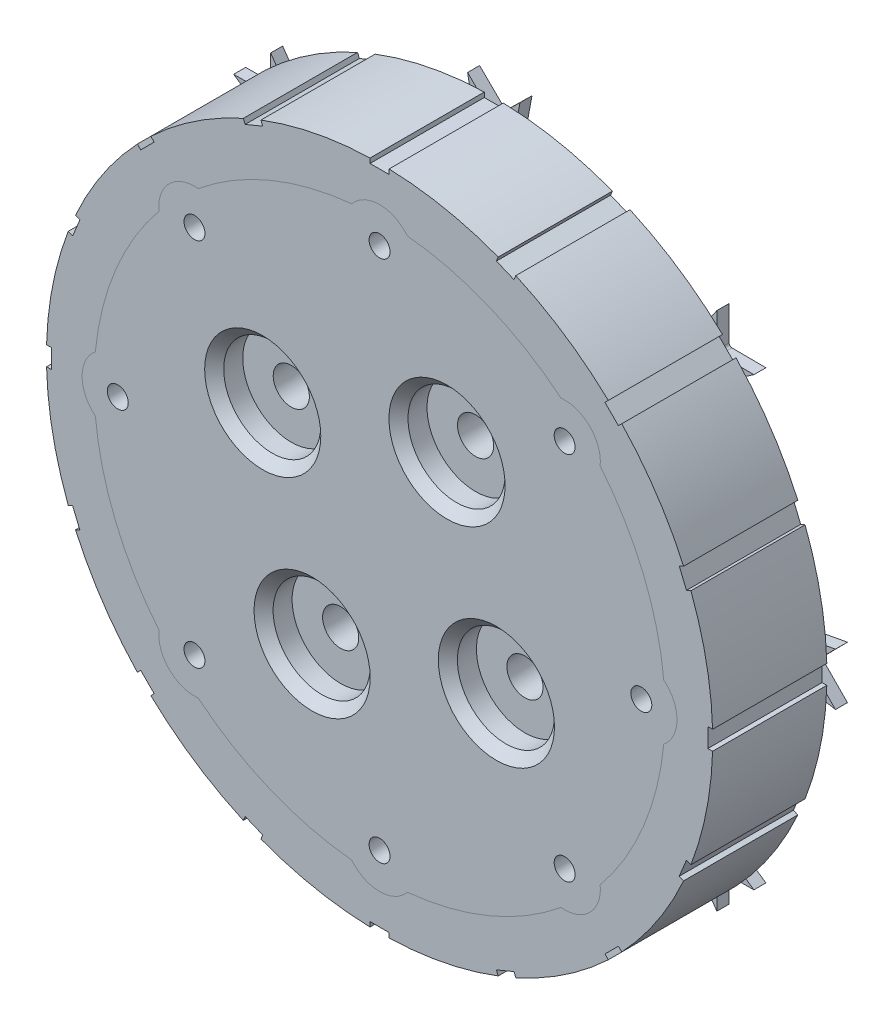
SolidWorks part; units mm, degrees
other "Hub"
other "Cleat"
other "Tire"
other "Mold Wall" parameters "D1"=32.9217, "D2"=23.0682, "D3"=8.255, "D4"=3.6898, "D5"=6.9844, "D6"=4.4103, "D7"=8.255
ref_plane "Front Plane" through (0, 0, 0) normal (0, 0, 1) x (1, 0, 0)
ref_plane "Top Plane" through (0, 0, 0) normal (0, 1, 0) x (1, 0, 0)
ref_plane "Right Plane" through (0, 0, 0) normal (1, 0, 0) x (0, 0, -1)
other "Bounding Box"
ref_plane "Default Plane" through (-8.9266, -12.7485, 0) normal (-0.1736, 0.9848, 0) x (0.9848, 0.1736, 0)
sketch "Sketch4" plane through (0, 0, 0) normal (1, 0, 0) x (0, 0, -1)
  line L0 (0, 0) -> (7.62, 0)
  line L1 (7.62, 0) -> (7.62, 38.1)
  line L2 (7.62, 38.1) -> (5.08, 38.1)
  line L3 (5.08, 38.1) -> (2.54, 25.4)
  line L4 (2.54, 25.4) -> (-2.54, 25.4)
  line L5 (-2.54, 25.4) -> (-5.08, 38.1)
  line L6 (-5.08, 38.1) -> (-7.62, 38.1)
  line L7 (-7.62, 38.1) -> (-7.62, 0)
  line L8 (-7.62, 0) -> (0, 0)
  line L9 (-26.5273, 44.45) -> (23587.5035, 44.45) construction
  line L10 (-36.4166, -44.45) -> (23577.6141, -44.45) construction
  line L11 (-7.4542, 0) -> (49992.5458, 0) construction
revolve "Revolve1" add sketch "Sketch4" angle 360 about L11
sketch "Sketch6" plane through (0, 0, 7.62) normal (0, 0, 1) x (1, 0, 0)
  line L0 (-4.7625, 34.925) -> (-4.7625, 0)
  line L1 (-4.7625, 0) -> (4.7625, 0)
  line L2 (4.7625, 0) -> (4.7625, 34.925)
  line L3 (0, 39.6875) -> (0, 44.45) construction
  arc A0 (4.7625, 34.925) -> (-4.7625, 34.925) centre (0, 34.925) ccw
  circle A1 centre (0, 0) radius 44.45 construction
extrude "Boss-Extrude2" add sketch "Sketch6" against normal up to vertex (16.51 mm away)
mirror "Mirror1" about plane through (0, 0, 0) normal (0, 0, 1) of "Boss-Extrude2"
sketch "Sketch7" plane through (0, 0, 5.08) normal (0, 0, -1) x (-1, 0, 0)
  circle A0 centre (0, 34.925) radius 4.7625
  arc A2 (3.7032, 37.9196) -> (-3.7032, 37.9196) centre (0, 34.925) ccw construction
extrude "Boss-Extrude3" add sketch "Sketch7" along normal up to surface (12.7 mm away)
sketch "Sketch8" plane through (0, 0, -7.62) normal (0, 0, -1) x (-1, 0, 0)
  circle A0 centre (0, 34.925) radius 1.397
extrude "Cut-Extrude2" cut sketch "Sketch8" against normal through all
fillet "Fillet2" radius 1.27 2 edges at (0.6334, 30.2048, -3.5023) (-0.6334, 30.2048, 3.5023)
pattern_circular "CirPattern2" count 8 over 360 of "Cut-Extrude2", "Boss-Extrude3", "Mirror1", "Boss-Extrude2", "Fillet2"
fillet "Fillet1" radius 1.27 2 edges at (25.4, 0, -2.54) (25.4, 0, 2.54)
sketch "Sketch2" plane through (0, 0, 0) normal (0, 0, 1) x (1, 0, 0)
  circle A0 centre (0, 0) radius 44.45
extrude "Boss-Extrude1" add sketch "Sketch2" along normal mid plane 15.24 separate body
sketch "Sketch3" plane through (0, 0, 7.62) normal (0, 0, 1) x (1, 0, 0)
  line L0 (-1.27, 44.4319) -> (-1.27, 43.7969)
  line L1 (-1.27, 43.7969) -> (1.27, 43.7969)
  line L2 (1.27, 43.7969) -> (1.27, 44.4319)
  line L3 (0, 43.7969) -> (0, 0) construction
  circle A0 centre (0, 0) radius 44.45 construction
  arc A1 (-1.27, 44.4319) -> (1.27, 44.4319) centre (0, 0) cw
  dimension "D1" = 0.635
  dimension "D2" = 2.54
extrude "Cut-Extrude1" cut sketch "Sketch3" against normal through all
pattern_circular "CirPattern1" count 16 over 360 about axis through (0, 0, 0) along (0, 0, 1) of "Cut-Extrude1"
move or copy body "Body-Move/Copy1" parameters "D1"=0, "D2"=0, "D3"=0
combine bodies "Combine1" bodies to combine 106 113
sketch "Sketch9" plane through (0, 0, -7.62) normal (0, 0, -1) x (-1, 0, 0)
  line L0 (0, 32.0675) -> (0, 35.8775) construction
  line L1 (0, 35.8775) -> (0, 39.6875) construction
  circle A0 centre (0, 0) radius 9.525 construction
  circle A1 centre (0, 0) radius 32.0675
  circle A2 centre (0, 0) radius 39.6875
  arc A4 (3.7032, 37.9196) -> (-3.7032, 37.9196) centre (0, 34.925) ccw construction
  dimension "D2" = 19.05
  dimension "D1" = 7.62
extrude "Boss-Extrude4" add sketch "Sketch9" along normal blind 1.6002 separate body
sketch "Sketch11" plane through (0, 0, -9.2202) normal (0, 0, -1) x (-1, 0, 0)
  circle A0 centre (0, 34.925) radius 4.445
  point P3 (0, 15.3326)
  dimension "D1" = 4.445
extrude "Boss-Extrude6" add sketch "Sketch11" against normal up to surface (1.6002 mm away)
sketch "Sketch12" plane through (0, 0, -9.2202) normal (0, 0, -1) x (-1, 0, 0)
  circle A0 centre (0, 34.925) radius 1.905
extrude "Cut-Extrude3" cut sketch "Sketch12" against normal through all
fillet "Fillet4" radius 3.81 2 edges at (-3.2583, 31.9015, -8.4201) (3.2583, 31.9015, -8.4201)
pattern_circular "CirPattern19" count 8 over 360 about axis through (0, 0, 0) along (0, 0, 1) of "Cut-Extrude3", "Fillet4", "Boss-Extrude6"
sketch "Sketch13" plane through (0, 0, -9.2202) normal (0, 0, -1) x (-1, 0, 0)
  line L1 (0, -7.479) -> (6.477, -3.7395)
  line L2 (6.477, -3.7395) -> (6.477, 3.7395)
  line L3 (6.477, 3.7395) -> (0, 7.479)
  line L4 (0, 7.479) -> (-6.477, 3.7395)
  line L5 (-6.477, 3.7395) -> (-6.477, -3.7395)
  line L6 (-6.477, -3.7395) -> (0, -7.479)
  circle A0 centre (0, 0) radius 6.477 construction
extrude "Cut-Extrude4" cut sketch "Sketch13" against normal through all
sketch "Sketch14" plane through (0, 0, -9.2202) normal (0, 0, -1) x (-1, 0, 0)
  line L3 (-2.3986, 39.615) -> (-3.4925, 45.5864)
  line L4 (-3.4925, 45.5864) -> (0, 42.1401)
  line L8 (-3.4925, 45.5864) -> (0, 0) construction
  line L10 (0, 0) -> (0, 50000) construction
  line L11 (-3.4925, 45.5864) -> (0, 45.5864) construction
  line L12 (0, 42.1401) -> (3.4925, 45.5864)
  line L13 (3.4925, 45.5864) -> (2.3986, 39.615)
  line L14 (2.3986, 39.615) -> (-2.3986, 39.615)
  circle A2 centre (0, 0) radius 44.45 construction
  arc A3 (-32.3161, 30.52) -> (-40.5637, 18.1767) centre (0, 0) ccw construction
  circle A4 centre (0, 0) radius 45.72 construction
  circle A5 centre (0, 0) radius 39.6875 construction
  dimension "D1" = 1.27
  dimension "D2" = 6
  dimension "D3" = 6.985
  dimension "D4" = 35
extrude "Boss-Extrude8" add sketch "Sketch14" against normal up to surface (1.6002 mm away)
fillet "Fillet6" radius 0.381 1 edges at (0, 42.1401, -8.4201)
fillet "Fillet7" radius 2.286 2 edges at (2.3986, 39.615, -8.4201) (-2.3986, 39.615, -8.4201)
pattern_circular "CirPattern27" count 8 over 360 about axis through (0, 0, 0) along (0, 0, 1) of "Boss-Extrude8", "Fillet7", "Fillet6"
sketch "Sketch15" plane through (0, 0, 7.62) normal (0, 0, 1) x (1, 0, 0)
  circle A0 centre (0, 0) radius 47.625
  arc A1 (-41.5357, 15.83) -> (-44.4319, 1.27) centre (0, 0) ccw construction
  dimension "D1" = 3.175
extrude "Boss-Extrude9" add sketch "Sketch15" against normal up to surface (15.24 mm away) separate body
move or copy body "Body-Move/Copy2" parameters "D1"=0, "D2"=0, "D3"=0
combine bodies "Combine2" bodies to combine 126 127 128
sketch "Sketch17" plane through (0, 0, 0) normal (0, 1, 0) x (1, 0, 0)
  line L0 (0, -10.16) -> (0, -7.62)
  line L1 (0, -7.62) -> (-47.7012, -7.62)
  line L2 (-47.7012, -7.62) -> (-47.7012, -1.27)
  line L3 (-47.7012, -1.27) -> (-50.2412, -1.27)
  line L4 (-50.2412, -1.27) -> (-50.2412, -10.16)
  line L5 (-50.2412, -10.16) -> (0, -10.16)
  line L6 (-47.625, -7.62) -> (47.625, -7.62) construction
  line L7 (-47.625, 7.62) -> (-47.625, -7.62) construction
  dimension "D1" = 2.54
  dimension "D2" = 0.0762
  dimension "D3" = 6.35
  dimension "D4" = 2.54
revolve "Revolve2" add sketch "Sketch17" angle 360 about L0
sketch "Sketch18" plane through (0, 0, 0) normal (0, 1, 0) x (1, 0, 0)
  line L0 (-47.625, 7.62) -> (-53.975, 13.97)
  line L1 (-53.975, 13.97) -> (-50.8, 13.97)
  line L2 (-50.8, 13.97) -> (-44.45, 7.62)
  line L3 (47.625, 7.62) -> (-47.625, 7.62) construction
  line L4 (-44.45, 7.62) -> (-47.625, 7.62)
  line L5 (0, 0) -> (0, 50000) construction
  dimension "D1" = 45
  dimension "D2" = 6.35
  dimension "D3" = 3.175
revolve "Revolve3" add sketch "Sketch18" angle 360 about L5
fillet "Fillet9" radius 5.08 1 edges at (47.625, 0, -7.62)
sketch "Sketch22" plane through (0, 0, -9.2202) normal (0, 0, -1) x (-1, 0, 0)
  circle A0 centre (0, 0) radius 30.734
  dimension "D1" = 61.468
extrude "Cut-Extrude6" cut sketch "Sketch22" against normal through all
sketch "Sketch56" plane through (0, 0, 7.62) normal (0, 0, 1) x (1, 0, 0)
  line L0 (6.477, -3.7395) -> (0, -7.479) construction
  line B0 (-12.0316, -4.2591) -> (-13.9201, -14.6984)
  line B1 (19.4044, -5.7691) -> (12.5493, 2.3273)
  line B2 (12.0316, 4.2591) -> (13.9201, 14.6984)
  line B3 (-19.4044, 5.7691) -> (-12.5493, -2.3273)
  line B4 (-6.35, 2.7695) -> (-6.35, -2.635)
  line B5 (-0.893, 6.8168) -> (-5.5735, 4.1145)
  line B6 (5.457, 4.1818) -> (0.893, 6.8168)
  line B7 (6.35, -2.7695) -> (6.35, 2.635)
  line B8 (0.893, -6.8168) -> (5.5735, -4.1145)
  line B9 (-5.457, -4.1818) -> (-0.893, -6.8168)
  circle B10 centre (-15.5885, 9) radius 2.0333
  circle B11 centre (9, 15.5885) radius 2.0333
  circle B12 centre (15.5885, -9) radius 2.0333
  arc B13 (-12.0316, -4.2591) -> (-12.5493, -2.3273) centre (-14.3381, -3.8419) ccw
  arc B14 (-13.9201, -14.6984) -> (-11.5, -19.9186) centre (-9, -15.5885) ccw
  arc B15 (-11.5, -19.9186) -> (19.9186, -11.5) centre (0, 0) ccw
  arc B16 (19.9186, -11.5) -> (19.4044, -5.7691) centre (15.5885, -9) ccw
  arc B17 (12.0316, 4.2591) -> (12.5493, 2.3273) centre (14.3381, 3.8419) ccw
  arc B18 (13.9201, 14.6984) -> (11.5, 19.9186) centre (9, 15.5885) ccw
  arc B19 (11.5, 19.9186) -> (-19.9186, 11.5) centre (0, 0) ccw
  arc B20 (-19.9186, 11.5) -> (-19.4044, 5.7691) centre (-15.5885, 9) ccw
  circle B21 centre (-9, -15.5885) radius 2.0333
  arc B22 (-10.7596, 10.2969) -> (-6.35, 2.7695) centre (5.1757, 14.5766) ccw
  arc B23 (-8.2319, 16.0074) -> (-10.7596, 10.2969) centre (-5.9583, 11.5863) ccw
  arc B24 (2.9523, 13.2062) -> (5.0877, 10.3977) centre (9, 15.5885) ccw
  arc B25 (-7.5459, 14.6734) -> (-9.3109, 10.6859) centre (-5.9583, 11.5863) ccw
  arc B26 (10.7596, -10.2969) -> (6.35, -2.7695) centre (-5.1757, -14.5766) ccw
  arc B27 (8.2319, -16.0074) -> (10.7596, -10.2969) centre (5.9583, -11.5863) ccw
  arc B28 (0.8747, -17.9787) -> (8.2319, -16.0074) centre (0, 0) ccw
  arc B29 (-4.1696, -14.2971) -> (0.8747, -17.9787) centre (0.6331, -13.0132) ccw
  arc B30 (-5.0877, -10.3977) -> (-5.9905, -11.5956) centre (-5.5391, -10.9966) ccw
  arc B31 (-2.9523, -13.2062) -> (-5.0877, -10.3977) centre (-9, -15.5885) ccw
  arc B32 (2.4388, -16.3188) -> (7.5459, -14.6734) centre (0, 0) ccw
  arc B33 (9.3109, -10.6859) -> (5.5735, -4.1145) centre (-5.1757, -14.5766) ccw
sketch_block_instance "Block-CoolS-2"
sketch_block "Block-CoolS"
sketch "Sketch36" plane through (0, 0, -7.62) normal (0, 0, -1) x (-1, 0, 0)
  line L0 (0, 0) -> (0, 13.5) construction
  line L9 (-19.4044, -5.7691) -> (-12.5493, 2.3273) construction
  line L10 (-12.0316, 4.2591) -> (-13.9201, 14.6984) construction
  line L11 (19.4044, 5.7691) -> (12.5493, -2.3273) construction
  line L12 (12.0316, -4.2591) -> (13.9201, -14.6984) construction
  line L13 (-19.4044, -5.7691) -> (-12.5493, 2.3273)
  line L14 (-12.0316, 4.2591) -> (-13.9201, 14.6984)
  line L15 (19.4044, 5.7691) -> (12.5493, -2.3273)
  line L16 (12.0316, -4.2591) -> (13.9201, -14.6984)
  arc A16 (-19.4044, -5.7691) -> (-19.9186, -11.5) centre (-15.5885, -9) ccw construction
  arc A17 (-12.5493, 2.3273) -> (-12.0316, 4.2591) centre (-14.3381, 3.8419) ccw construction
  arc A18 (-11.5, 19.9186) -> (-13.9201, 14.6984) centre (-9, 15.5885) ccw construction
  arc A19 (19.9186, 11.5) -> (-11.5, 19.9186) centre (0, 0) ccw construction
  arc A20 (19.4044, 5.7691) -> (19.9186, 11.5) centre (15.5885, 9) ccw construction
  arc A21 (12.5493, -2.3273) -> (12.0316, -4.2591) centre (14.3381, -3.8419) ccw construction
  arc A22 (11.5, -19.9186) -> (13.9201, -14.6984) centre (9, -15.5885) ccw construction
  arc A23 (-19.9186, -11.5) -> (11.5, -19.9186) centre (0, 0) ccw construction
  arc A24 (-19.4044, -5.7691) -> (-19.9186, -11.5) centre (-15.5885, -9) ccw
  arc A25 (-12.5493, 2.3273) -> (-12.0316, 4.2591) centre (-14.3381, 3.8419) ccw
  arc A26 (-11.5, 19.9186) -> (-13.9201, 14.6984) centre (-9, 15.5885) ccw
  arc A27 (19.9186, 11.5) -> (-11.5, 19.9186) centre (0, 0) ccw
  arc A28 (19.4044, 5.7691) -> (19.9186, 11.5) centre (15.5885, 9) ccw
  arc A29 (12.5493, -2.3273) -> (12.0316, -4.2591) centre (14.3381, -3.8419) ccw
  arc A30 (11.5, -19.9186) -> (13.9201, -14.6984) centre (9, -15.5885) ccw
  arc A31 (-19.9186, -11.5) -> (11.5, -19.9186) centre (0, 0) ccw
extrude "Cut-Extrude11" cut sketch "Sketch36" against normal blind 5.08
sketch "Sketch37" plane through (0, 0, -7.62) normal (0, 0, -1) x (-1, 0, 0)
  line L4 (-12.5493, 2.3273) -> (-19.4044, -5.7691)
  line L6 (-12.5493, 2.3273) -> (-19.4044, -5.7691)
  line L8 (13.9201, -14.6984) -> (12.0316, -4.2591)
  line L10 (13.9201, -14.6984) -> (12.0316, -4.2591)
  line L12 (-13.9201, 14.6984) -> (-12.0316, 4.2591)
  line L13 (-13.9201, 14.6984) -> (-12.0316, 4.2591)
  line L14 (12.5493, -2.3273) -> (19.4044, 5.7691)
  line L15 (12.5493, -2.3273) -> (19.4044, 5.7691)
  circle A1 centre (0, 0) radius 24.13
  arc A9 (-19.4044, -5.7691) -> (-19.9186, -11.5) centre (-15.5885, -9) ccw
  arc A11 (-19.9186, -11.5) -> (11.5, -19.9186) centre (0, 0) ccw
  arc A12 (-19.9186, -11.5) -> (11.5, -19.9186) centre (0, 0) ccw
  arc A13 (-19.4044, -5.7691) -> (-19.9186, -11.5) centre (-15.5885, -9) ccw
  arc A15 (12.5493, -2.3273) -> (12.0316, -4.2591) centre (14.3381, -3.8419) ccw
  arc A16 (12.5493, -2.3273) -> (12.0316, -4.2591) centre (14.3381, -3.8419) ccw
  arc A17 (11.5, -19.9186) -> (13.9201, -14.6984) centre (9, -15.5885) ccw
  arc A19 (11.5, -19.9186) -> (13.9201, -14.6984) centre (9, -15.5885) ccw
  arc A21 (19.4044, 5.7691) -> (19.9186, 11.5) centre (15.5885, 9) ccw
  arc A23 (-12.5493, 2.3273) -> (-12.0316, 4.2591) centre (-14.3381, 3.8419) ccw
  arc A24 (-12.5493, 2.3273) -> (-12.0316, 4.2591) centre (-14.3381, 3.8419) ccw
  arc A25 (19.4044, 5.7691) -> (19.9186, 11.5) centre (15.5885, 9) ccw
  arc A26 (-11.5, 19.9186) -> (-13.9201, 14.6984) centre (-9, 15.5885) ccw
  arc A27 (-11.5, 19.9186) -> (-13.9201, 14.6984) centre (-9, 15.5885) ccw
  arc A28 (19.9186, 11.5) -> (-11.5, 19.9186) centre (0, 0) ccw
  arc A29 (19.9186, 11.5) -> (-11.5, 19.9186) centre (0, 0) ccw
  dimension "D2" = 48.26
  dimension "D1" = 0
extrude "Boss-Extrude12" add sketch "Sketch37" along normal offset from surface (4.445 mm away) 9.525
chamfer "Chamfer3" distance 5.715 angle 45 2 edges at (24.13, 0, -7.62) (-24.13, 0, -12.065)
sketch "Sketch39" plane through (0, 0, -2.54) normal (0, 0, -1) x (-1, 0, 0)
  circle A0 centre (-9, 15.5885) radius 2.413
  circle A1 centre (15.5885, 9) radius 2.413
  circle A2 centre (9, -15.5885) radius 2.413
  circle A3 centre (-15.5885, -9) radius 2.413
  dimension "D1" = 4.826
extrude "Cut-Extrude12" cut sketch "Sketch39" against normal through all
sketch "Sketch50" plane through (0, 0, 7.62) normal (0, 0, 1) x (1, 0, 0)
  circle A0 centre (-15.5885, 9) radius 6.477
  circle A1 centre (9, 15.5885) radius 6.477
  circle A2 centre (15.5885, -9) radius 6.477
  circle A3 centre (-9, -15.5885) radius 6.477
  dimension "D1" = 12.954
extrude "Cut-Extrude13" cut sketch "Sketch50" against normal blind 3.81
sketch "Sketch54" plane through (0, 0, -12.065) normal (0, 0, -1) x (-1, 0, 0)
  line L0 (19.4044, 5.7691) -> (12.5493, -2.3273) construction
  line L1 (-19.4044, -5.7691) -> (-12.5493, 2.3273) construction
  circle A0 centre (-15.9768, -1.7209) radius 5.08
  circle A1 centre (15.9768, 1.7209) radius 5.08
  dimension "D1" = 10.16
extrude "Cut-Extrude14" cut sketch "Sketch54" against normal up to surface (9.525 mm away)
fillet "Fillet10" radius 3.81 4 edges at (-12.6942, -2.1561, -7.3025) (-19.2594, 5.5979, -7.3025) (12.6942, 2.1561, -7.3025) (19.2594, -5.5979, -7.3025)
sketch "Sketch57" plane through (0, 0, 7.62) normal (0, 0, 1) x (1, 0, 0)
  line L0 (6.477, 3.7395) -> (6.477, -3.7395) construction
  line L1 (0, 7.479) -> (6.477, 3.7395) construction
  line L2 (-6.477, 3.7395) -> (0, 7.479) construction
  line L3 (-6.477, -3.7395) -> (-6.477, 3.7395) construction
  line L4 (0, -7.479) -> (-6.477, -3.7395) construction
  line L5 (6.477, -3.7395) -> (0, -7.479) construction
  line L6 (6.477, 3.7395) -> (6.477, -3.7395)
  line L7 (0, 7.479) -> (6.477, 3.7395)
  line L8 (-6.477, 3.7395) -> (0, 7.479)
  line L9 (-6.477, -3.7395) -> (-6.477, 3.7395)
  line L10 (0, -7.479) -> (-6.477, -3.7395)
  line L11 (6.477, -3.7395) -> (0, -7.479)
extrude "Boss-Extrude13" add sketch "Sketch57" against normal blind 5.08
chamfer "Chamfer4" distance 1.27 angle 45 4 edges at (-2.523, -15.5885, 7.62) (22.0655, -9, 7.62) (15.477, 15.5885, 7.62) (-9.1115, 9, 7.62)
sketch "Sketch60" [suppressed] plane through (0, 0, 7.62) normal (0, 0, -1) x (-1, 0, 0)
  circle A0 centre (15.5885, 9) radius 2.413 construction
  circle A1 centre (9, -15.5885) radius 2.413 construction
  circle A2 centre (-15.5885, -9) radius 2.413 construction
  circle A3 centre (-9, 15.5885) radius 2.413 construction
  circle A4 centre (15.5885, 9) radius 2.413
  circle A5 centre (9, -15.5885) radius 2.413
  circle A6 centre (-15.5885, -9) radius 2.413
  circle A7 centre (-9, 15.5885) radius 2.413
extrude "Boss-Extrude14" [suppressed] add sketch "Sketch60" along normal blind 19.05
chamfer "Chamfer5" [suppressed] distance 4.318 angle 45
chamfer "Chamfer6" [suppressed] distance 0.762 angle 45
fillet "Fillet11" [suppressed] radius 2.54
delete or keep bodies "Body-Delete/Keep 2" bodies 131 132
delete or keep bodies "Body-Delete/Keep 3" [suppressed] bodies 135
delete or keep bodies "Body-Delete/Keep 4" [suppressed] type keep bodies bodies 132 156
sketch "Sketch61" [suppressed] plane through (0, 0, -9.2202) normal (0, 0, -1) x (-1, 0, 0)
  line L0 (-3.4925, 45.5864) -> (-2.776, 41.675) construction
  line L1 (-27.5058, 31.4316) -> (-29.7649, 34.704) construction
  line L2 (-3.1352, 43.636) -> (-2.776, 41.675)
  line L3 (-27.5058, 31.4316) -> (-28.6384, 33.0723)
  arc A0 (-4.2081, 33.4932) -> (-1.389, 30.7026) centre (0, 34.925) ccw construction
  arc A1 (-4.2081, 33.4932) -> (-7.1165, 35.1646) centre (-6.6127, 32.6751) ccw construction
  arc A2 (-7.1165, 35.1646) -> (-19.833, 29.8973) centre (0, 0) ccw construction
  arc A3 (-19.833, 29.8973) -> (-20.7077, 26.6589) centre (-18.4289, 27.7807) ccw construction
  arc A4 (-20.7278, 22.6922) -> (-20.7077, 26.6589) centre (-24.6957, 24.6957) ccw construction
  arc A5 (-4.2081, 33.4932) -> (-1.389, 30.7026) centre (0, 34.925) ccw
  arc A6 (-4.2081, 33.4932) -> (-7.1165, 35.1646) centre (-6.6127, 32.6751) ccw
  arc A7 (-7.1165, 35.1646) -> (-19.833, 29.8973) centre (0, 0) ccw
  arc A8 (-19.833, 29.8973) -> (-20.7077, 26.6589) centre (-18.4289, 27.7807) ccw
  arc A9 (-20.7278, 22.6922) -> (-20.7077, 26.6589) centre (-24.6957, 24.6957) ccw
  arc A10 (-20.7278, 22.6922) -> (-1.389, 30.7026) centre (0, 0) cw
  arc A11 (-4.4368, 39.4387) -> (-2.776, 41.675) centre (-4.6498, 41.3318) ccw construction
  arc A12 (-4.4368, 39.4387) -> (-24.7501, 31.0247) centre (0, 0) ccw construction
  arc A13 (-27.5058, 31.4316) -> (-24.7501, 31.0247) centre (-25.9381, 32.5139) ccw construction
  arc A14 (-4.4368, 39.4387) -> (-2.776, 41.675) centre (-4.6498, 41.3318) ccw
  arc A15 (-4.4368, 39.4387) -> (-6.28, 39.1875) centre (0, 0) ccw
  arc A16 (-27.5058, 31.4316) -> (-24.7501, 31.0247) centre (-25.9381, 32.5139) ccw
  arc A17 (-28.6384, 33.0723) -> (-23.2691, 32.1503) centre (-25.503, 35.2368) ccw
  arc A18 (-6.28, 39.1875) -> (-3.1352, 43.636) centre (-6.8828, 42.9495) ccw
  arc A19 (-23.2691, 32.1503) -> (-24.7501, 31.0247) centre (0, 0) ccw
  dimension "D1" = 7.62
extrude "Boss-Extrude15" [suppressed] add sketch "Sketch61" against normal up to surface (1.6002 mm away)
pattern_circular "CirPattern28" [suppressed] count 8 over 360
sketch "Sketch62" [suppressed] plane through (0, 0, -9.2202) normal (0, 0, -1) x (-1, 0, 0)
  line L0 (-0.889, 23.7769) -> (-0.889, 30.7211)
  line L1 (0.889, 23.7769) -> (0.889, 30.7211)
  line L2 (0, 12.7) -> (0, 50012.7) construction
  line L3 (-0.889, 1.6231) -> (-0.889, 0)
  line L4 (-0.889, 0) -> (0.889, 0)
  line L5 (0.889, 0) -> (0.889, 1.6231)
  circle A0 centre (0, 12.7) radius 6.35
  arc A1 (-0.889, 23.7769) -> (-0.889, 1.6231) centre (0, 12.7) ccw
  circle A2 centre (0, 0) radius 30.734 construction
  arc A3 (0.889, 30.7211) -> (-0.889, 30.7211) centre (0, 0) ccw
  arc A4 (0.889, 1.6231) -> (0.889, 23.7769) centre (0, 12.7) ccw
  point P12 (0, 30.734)
  dimension "D1" = 12.7
  dimension "D2" = 22.225
  dimension "D3" = 12.7
  dimension "D4" = 1.778
extrude "Boss-Extrude16" [suppressed] add sketch "Sketch62" against normal up to surface (1.6002 mm away)
mirror "Mirror2" [suppressed] about plane through (0, 0, 0) normal (0, 1, 0)
equation "\"Wheel Diameter\"= 3.5"
equation "\"Number Spokes\"=8"
equation "\"Number Spikes\"=8"
equation "\"Screw Hole Size\"= .15in"
equation "\"Hex Bore\"= .51in"
equation "\"D1@Sketch2\"=\"Wheel Diameter\""
equation "\"Wheel Thickness\"= .6in"
equation "\"Cleat Thickness\"= .063in"
equation "\"D1@Boss-Extrude1\"=\"Wheel Thickness\""
equation "\"Number Devots\"= 16"
equation "\"D1@CirPattern1\"=\"Number Devots\""
equation "\"D1@Sketch4\"=\"Wheel Diameter\""
equation "\"D2@Sketch4\"=\"Wheel Thickness\""
equation "\"D3@Sketch4\"=\"Wheel Diameter\"/2"
equation "\"D2@Sketch6\"=\"Wheel Diameter\""
equation "\"D1@Sketch8\"=\"Screw Hole Size\"-.04"
equation "\"D1@CirPattern2\"=\"Number Spokes\""
equation "\"D1@Boss-Extrude4\"=\"Cleat Thickness\""
equation "\"D1@Sketch12\"=\"Screw Hole Size\""
equation "\"D1@Sketch13\"=\"Hex Bore\""
equation "\"D1@CirPattern27\"=\"Number Spikes\""
